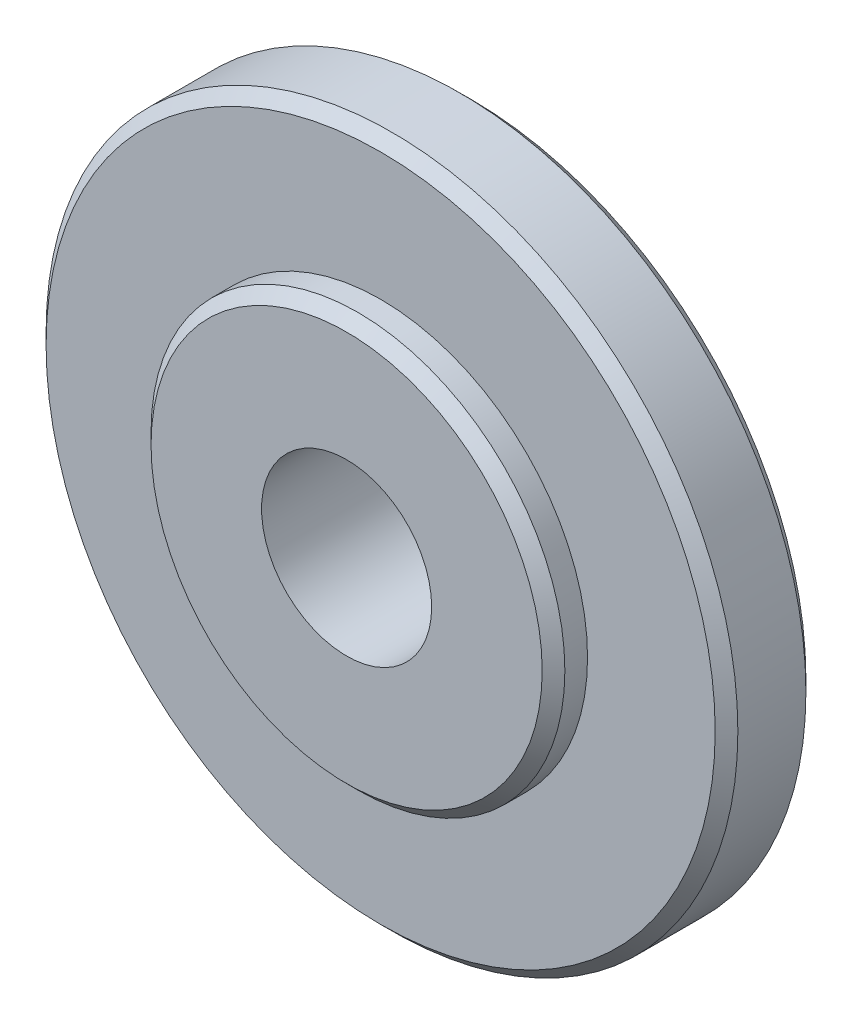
SolidWorks part; units mm, degrees
ref_plane "Plan de face" through (0, 0, 0) normal (0, 0, 1) x (1, 0, 0)
ref_plane "Plan de dessus" through (0, 0, 0) normal (0, 1, 0) x (1, 0, 0)
ref_plane "Plan de droite" through (0, 0, 0) normal (1, 0, 0) x (0, 0, -1)
sketch "Esquisse1" plane through (0, 0, 0) normal (1, 0, 0) x (0, 0, -1)
  line L0 (0, 0) -> (67.541, 0) construction
  line L1 (1, 18.2452) -> (3, 18.2452)
  line L2 (3, 18.2452) -> (3, 29.5)
  line L3 (4, 30.5) -> (10, 30.5)
  line L4 (11, 29.5) -> (11, 7.5)
  line L5 (11, 7.5) -> (0, 7.5)
  line L6 (0, 7.5) -> (0, 17.2452)
  line L7 (3, 29.5) -> (4, 30.5)
  line L8 (0, 17.2452) -> (1, 18.2452)
  line L9 (10, 30.5) -> (11, 29.5)
  point P3 (0, 18.2452)
  point P6 (3, 30.5)
  point P7 (11, 30.5)
  dimension "D1" = 15
  dimension "D2" = 61
  dimension "D3" = 11
  dimension "D4" = 8
  dimension "D5" = 1
  dimension "D6" = 45
  dimension "D7" = 1
  dimension "D8" = 45
  dimension "D9" = 1
  dimension "D10" = 45
revolve "Révolution1" add sketch "Esquisse1" angle 360 about L0
